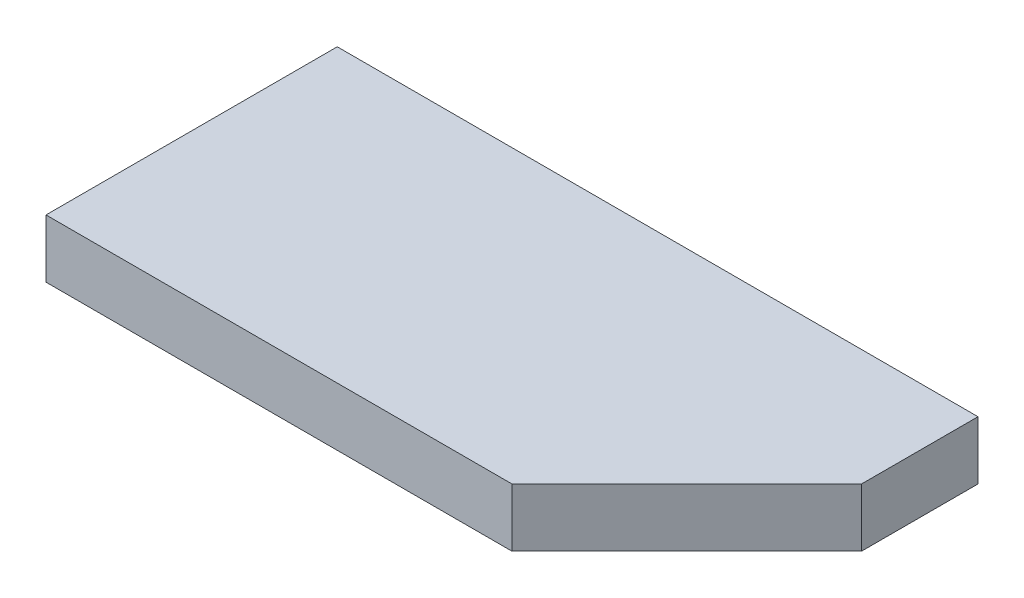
SolidWorks part; units mm, degrees
ref_plane "Front Plane" through (0, 0, 0) normal (0, 0, 1) x (1, 0, 0)
ref_plane "Top Plane" through (0, 0, 0) normal (0, 1, 0) x (1, 0, 0)
ref_plane "Right Plane" through (0, 0, 0) normal (1, 0, 0) x (0, 0, -1)
sketch "Sketch2" plane through (0, 0, 0) normal (0, 1, 0) x (1, 0, 0)
  line L0 (0, 0) -> (40, 0)
  line L1 (40, 0) -> (55, 15)
  line L2 (55, 15) -> (55, 25)
  line L3 (55, 25) -> (0, 25)
  line L4 (0, 25) -> (0, 0)
  dimension "D1" = 25
  dimension "D2" = 55
  dimension "D3" = 45
  dimension "D4" = 40
extrude "Extrude1" add sketch "Sketch2" along normal blind 5
